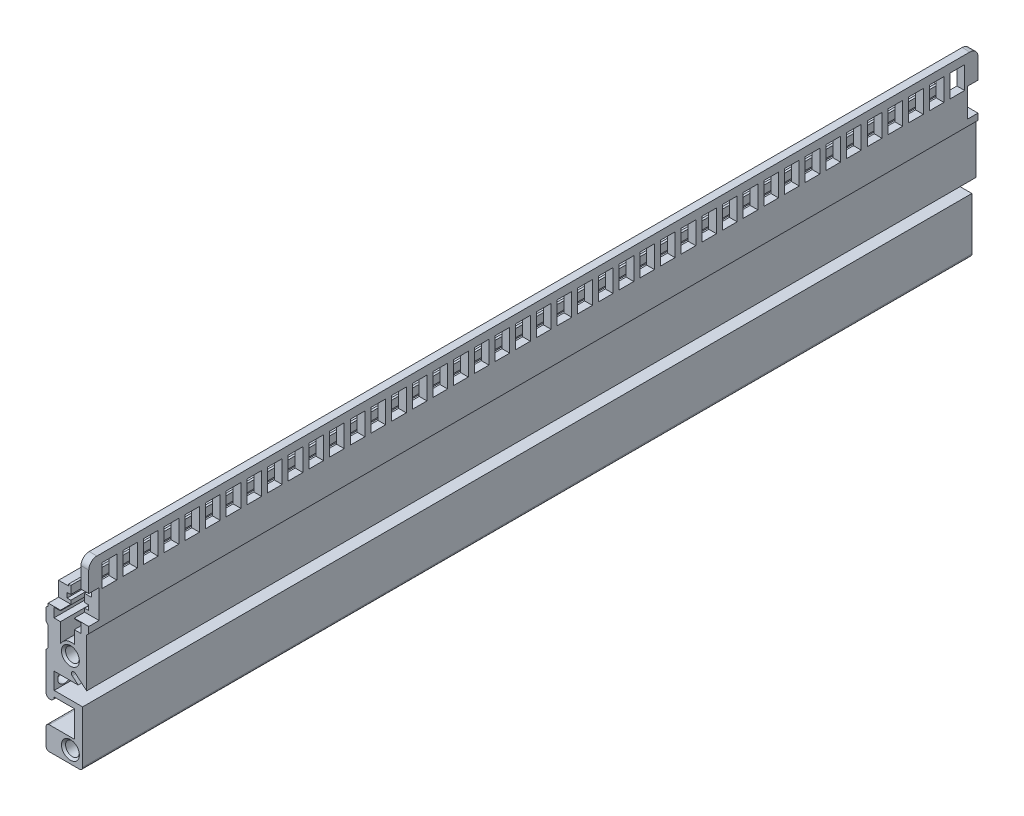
SolidWorks part; units mm, degrees
ref_plane "前视基准面" through (0, 0, 0) normal (0, 0, 1) x (1, 0, 0)
ref_plane "上视基准面" through (0, 0, 0) normal (0, 1, 0) x (1, 0, 0)
ref_plane "右视基准面" through (0, 0, 0) normal (1, 0, 0) x (0, 0, -1)
sketch "草图1" plane through (0, 0, 0) normal (0, 0, 1) x (1, 0, 0)
  line L0 (2.6, 12.5) -> (2.6, 22.5)
  line L1 (0.95, 12.5) -> (2.6, 12.5)
  line L2 (2.6, 22.5) -> (4.5, 22.5)
  line L3 (0.95, 10.55) -> (0.95, 12.5)
  line L4 (4.5, 22.5) -> (4.5, 6.95)
  line L5 (1.85, 10.55) -> (0.95, 10.55)
  line L6 (4, 6.45) -> (4.5, 6.95)
  line L7 (1.85, 9.35) -> (1.85, 10.55)
  line L8 (4, 6.45) -> (4, -5.4458)
  line L9 (0.95, 9.35) -> (1.85, 9.35)
  line L10 (1.2224, -3.1152) -> (4, -5.4458)
  line L11 (0.95, 8.35) -> (0.95, 9.35)
  line L12 (2.55, 8.35) -> (0.95, 8.35)
  line L13 (0.4511, -4.0344) -> (1.8998, -5.25)
  line L14 (2.55, 6.05) -> (2.55, 8.35)
  line L15 (-4, -5.25) -> (1.8998, -5.25)
  line L16 (0.95, 6.05) -> (2.55, 6.05)
  line L17 (-4, -9.35) -> (-4, -5.25)
  line L18 (0.95, 2.9172) -> (0.95, 6.05)
  line L19 (-4, -9.35) -> (3, -9.35)
  line L20 (3, -9.35) -> (3, -22.2)
  line L21 (-2.45, 6.05) -> (-2.45, 1.3077)
  line L22 (-4.05, 6.05) -> (-2.45, 6.05)
  line L23 (2.2, -23) -> (-5.2, -23)
  line L24 (-4.05, 8.35) -> (-4.05, 6.05)
  line L25 (-2.45, 8.35) -> (-4.05, 8.35)
  line L26 (-6, -22.2) -> (-6, -18.05)
  line L27 (-2.45, 9.35) -> (-2.45, 8.35)
  line L28 (-3.35, 9.35) -> (-2.45, 9.35)
  line L29 (-5.2, -17.25) -> (1, -17.25)
  line L30 (-3.35, 10.55) -> (-3.35, 9.35)
  line L31 (1, -10.75) -> (1, -17.25)
  line L32 (-2.45, 10.55) -> (-3.35, 10.55)
  line L33 (-4, -10.75) -> (1, -10.75)
  line L34 (-2.45, 12.5) -> (-2.45, 10.55)
  line L35 (-2.45, 12.5) -> (-3, 12.5)
  line L36 (-6, -10.75) -> (-6, -1.6)
  line L37 (-3, 12.5) -> (-3, 12.1)
  line L38 (-6, -1.6) -> (-5.5501, -1.1002)
  line L39 (-3, 12.1) -> (-5.45, 12.1)
  line L40 (-5.5499, 3.8998) -> (-5.5501, -1.1002)
  line L41 (-5.45, 12.1) -> (-5.45, 7.7)
  line L42 (-5.5499, 3.8998) -> (-6, 4.4)
  line L43 (-5.45, 7.7) -> (-5.7, 7.7)
  line L44 (-6, 4.4) -> (-6, 7.4)
  line L45 (-6, 7.4) -> (-5.7, 7.7)
  circle A0 centre (0, 0) radius 1.7
  circle A1 centre (0, -20) radius 1.7
  arc A2 (1.2224, -3.1152) -> (0.4511, -4.0344) centre (0.8368, -3.5748) ccw
  arc A3 (0.95, 2.9172) -> (-2.45, 1.3077) centre (0.25, 0) ccw
  arc A4 (2.2, -23) -> (3, -22.2) centre (2.2, -22.2) ccw
  arc A5 (-6, -22.2) -> (-5.2, -23) centre (-5.2, -22.2) ccw
  arc A6 (-5.2, -17.25) -> (-6, -18.05) centre (-5.2, -18.05) ccw
  arc A7 (-6, -10.75) -> (-4, -10.75) centre (-5, -10.75) ccw
extrude "凸台-拉伸1" add sketch "草图1" against normal blind 218.44
fillet "圆角1" radius 2 2 edges at (3.55, 22.5, -218.44) (3.55, 22.5, 0)
sketch "草图2" plane through (4.5, 0, 0) normal (1, 0, 0) x (0, 0, -1)
  line L0 (8.36, 20.45) -> (11.96, 20.45)
  line L1 (3.28, 20.45) -> (6.88, 20.45)
  line L2 (3.28, 20.45) -> (3.28, 14.95)
  line L3 (3.28, 14.95) -> (6.88, 14.95)
  line L4 (6.88, 20.45) -> (6.88, 14.95)
  line L5 (5.08, 20.45) -> (5.08, 14.95) construction
  line L6 (3.28, 17.7) -> (6.88, 17.7) construction
  line L7 (216.44, 22.5) -> (2, 22.5) construction
  line L8 (0, 20.5) -> (0, 12.5) construction
  line L9 (8.36, 20.45) -> (8.36, 14.95)
  line L10 (8.36, 14.95) -> (11.96, 14.95)
  line L11 (11.96, 20.45) -> (11.96, 14.95)
  line L12 (10.16, 20.45) -> (10.16, 14.95) construction
  line L13 (8.36, 17.7) -> (11.96, 17.7) construction
  line L14 (13.44, 20.45) -> (17.04, 20.45)
  line L15 (13.44, 20.45) -> (13.44, 14.95)
  line L16 (13.44, 14.95) -> (17.04, 14.95)
  line L17 (17.04, 20.45) -> (17.04, 14.95)
  line L18 (15.24, 20.45) -> (15.24, 14.95) construction
  line L19 (13.44, 17.7) -> (17.04, 17.7) construction
  line L20 (18.52, 20.45) -> (22.12, 20.45)
  line L21 (18.52, 20.45) -> (18.52, 14.95)
  line L22 (18.52, 14.95) -> (22.12, 14.95)
  line L23 (22.12, 20.45) -> (22.12, 14.95)
  line L24 (20.32, 20.45) -> (20.32, 14.95) construction
  line L25 (18.52, 17.7) -> (22.12, 17.7) construction
  line L26 (23.6, 20.45) -> (27.2, 20.45)
  line L27 (23.6, 20.45) -> (23.6, 14.95)
  line L28 (23.6, 14.95) -> (27.2, 14.95)
  line L29 (27.2, 20.45) -> (27.2, 14.95)
  line L30 (25.4, 20.45) -> (25.4, 14.95) construction
  line L31 (23.6, 17.7) -> (27.2, 17.7) construction
  line L32 (28.68, 20.45) -> (32.28, 20.45)
  line L33 (28.68, 20.45) -> (28.68, 14.95)
  line L34 (28.68, 14.95) -> (32.28, 14.95)
  line L35 (32.28, 20.45) -> (32.28, 14.95)
  line L36 (30.48, 20.45) -> (30.48, 14.95) construction
  line L37 (28.68, 17.7) -> (32.28, 17.7) construction
  line L38 (33.76, 20.45) -> (37.36, 20.45)
  line L39 (33.76, 20.45) -> (33.76, 14.95)
  line L40 (33.76, 14.95) -> (37.36, 14.95)
  line L41 (37.36, 20.45) -> (37.36, 14.95)
  line L42 (35.56, 20.45) -> (35.56, 14.95) construction
  line L43 (33.76, 17.7) -> (37.36, 17.7) construction
  line L44 (38.84, 20.45) -> (42.44, 20.45)
  line L45 (38.84, 20.45) -> (38.84, 14.95)
  line L46 (38.84, 14.95) -> (42.44, 14.95)
  line L47 (42.44, 20.45) -> (42.44, 14.95)
  line L48 (40.64, 20.45) -> (40.64, 14.95) construction
  line L49 (38.84, 17.7) -> (42.44, 17.7) construction
  line L50 (43.92, 20.45) -> (47.52, 20.45)
  line L51 (43.92, 20.45) -> (43.92, 14.95)
  line L52 (43.92, 14.95) -> (47.52, 14.95)
  line L53 (47.52, 20.45) -> (47.52, 14.95)
  line L54 (45.72, 20.45) -> (45.72, 14.95) construction
  line L55 (43.92, 17.7) -> (47.52, 17.7) construction
  line L56 (49, 20.45) -> (52.6, 20.45)
  line L57 (49, 20.45) -> (49, 14.95)
  line L58 (49, 14.95) -> (52.6, 14.95)
  line L59 (52.6, 20.45) -> (52.6, 14.95)
  line L60 (50.8, 20.45) -> (50.8, 14.95) construction
  line L61 (49, 17.7) -> (52.6, 17.7) construction
  line L62 (54.08, 20.45) -> (57.68, 20.45)
  line L63 (54.08, 20.45) -> (54.08, 14.95)
  line L64 (54.08, 14.95) -> (57.68, 14.95)
  line L65 (57.68, 20.45) -> (57.68, 14.95)
  line L66 (55.88, 20.45) -> (55.88, 14.95) construction
  line L67 (54.08, 17.7) -> (57.68, 17.7) construction
  line L68 (59.16, 20.45) -> (62.76, 20.45)
  line L69 (59.16, 20.45) -> (59.16, 14.95)
  line L70 (59.16, 14.95) -> (62.76, 14.95)
  line L71 (62.76, 20.45) -> (62.76, 14.95)
  line L72 (60.96, 20.45) -> (60.96, 14.95) construction
  line L73 (59.16, 17.7) -> (62.76, 17.7) construction
  line L74 (64.24, 20.45) -> (67.84, 20.45)
  line L75 (64.24, 20.45) -> (64.24, 14.95)
  line L76 (64.24, 14.95) -> (67.84, 14.95)
  line L77 (67.84, 20.45) -> (67.84, 14.95)
  line L78 (66.04, 20.45) -> (66.04, 14.95) construction
  line L79 (64.24, 17.7) -> (67.84, 17.7) construction
  line L80 (69.32, 20.45) -> (72.92, 20.45)
  line L81 (69.32, 20.45) -> (69.32, 14.95)
  line L82 (69.32, 14.95) -> (72.92, 14.95)
  line L83 (72.92, 20.45) -> (72.92, 14.95)
  line L84 (71.12, 20.45) -> (71.12, 14.95) construction
  line L85 (69.32, 17.7) -> (72.92, 17.7) construction
  line L86 (74.4, 20.45) -> (78, 20.45)
  line L87 (74.4, 20.45) -> (74.4, 14.95)
  line L88 (74.4, 14.95) -> (78, 14.95)
  line L89 (78, 20.45) -> (78, 14.95)
  line L90 (76.2, 20.45) -> (76.2, 14.95) construction
  line L91 (74.4, 17.7) -> (78, 17.7) construction
  line L92 (79.48, 20.45) -> (83.08, 20.45)
  line L93 (79.48, 20.45) -> (79.48, 14.95)
  line L94 (79.48, 14.95) -> (83.08, 14.95)
  line L95 (83.08, 20.45) -> (83.08, 14.95)
  line L96 (81.28, 20.45) -> (81.28, 14.95) construction
  line L97 (79.48, 17.7) -> (83.08, 17.7) construction
  line L98 (84.56, 20.45) -> (88.16, 20.45)
  line L99 (84.56, 20.45) -> (84.56, 14.95)
  line L100 (84.56, 14.95) -> (88.16, 14.95)
  line L101 (88.16, 20.45) -> (88.16, 14.95)
  line L102 (86.36, 20.45) -> (86.36, 14.95) construction
  line L103 (84.56, 17.7) -> (88.16, 17.7) construction
  line L104 (89.64, 20.45) -> (93.24, 20.45)
  line L105 (89.64, 20.45) -> (89.64, 14.95)
  line L106 (89.64, 14.95) -> (93.24, 14.95)
  line L107 (93.24, 20.45) -> (93.24, 14.95)
  line L108 (91.44, 20.45) -> (91.44, 14.95) construction
  line L109 (89.64, 17.7) -> (93.24, 17.7) construction
  line L110 (94.72, 20.45) -> (98.32, 20.45)
  line L111 (94.72, 20.45) -> (94.72, 14.95)
  line L112 (94.72, 14.95) -> (98.32, 14.95)
  line L113 (98.32, 20.45) -> (98.32, 14.95)
  line L114 (96.52, 20.45) -> (96.52, 14.95) construction
  line L115 (94.72, 17.7) -> (98.32, 17.7) construction
  line L116 (99.8, 20.45) -> (103.4, 20.45)
  line L117 (99.8, 20.45) -> (99.8, 14.95)
  line L118 (99.8, 14.95) -> (103.4, 14.95)
  line L119 (103.4, 20.45) -> (103.4, 14.95)
  line L120 (101.6, 20.45) -> (101.6, 14.95) construction
  line L121 (99.8, 17.7) -> (103.4, 17.7) construction
  line L122 (104.88, 20.45) -> (108.48, 20.45)
  line L123 (104.88, 20.45) -> (104.88, 14.95)
  line L124 (104.88, 14.95) -> (108.48, 14.95)
  line L125 (108.48, 20.45) -> (108.48, 14.95)
  line L126 (106.68, 20.45) -> (106.68, 14.95) construction
  line L127 (104.88, 17.7) -> (108.48, 17.7) construction
  line L128 (109.96, 20.45) -> (113.56, 20.45)
  line L129 (109.96, 20.45) -> (109.96, 14.95)
  line L130 (109.96, 14.95) -> (113.56, 14.95)
  line L131 (113.56, 20.45) -> (113.56, 14.95)
  line L132 (111.76, 20.45) -> (111.76, 14.95) construction
  line L133 (109.96, 17.7) -> (113.56, 17.7) construction
  line L134 (115.04, 20.45) -> (118.64, 20.45)
  line L135 (115.04, 20.45) -> (115.04, 14.95)
  line L136 (115.04, 14.95) -> (118.64, 14.95)
  line L137 (118.64, 20.45) -> (118.64, 14.95)
  line L138 (116.84, 20.45) -> (116.84, 14.95) construction
  line L139 (115.04, 17.7) -> (118.64, 17.7) construction
  line L140 (120.12, 20.45) -> (123.72, 20.45)
  line L141 (120.12, 20.45) -> (120.12, 14.95)
  line L142 (120.12, 14.95) -> (123.72, 14.95)
  line L143 (123.72, 20.45) -> (123.72, 14.95)
  line L144 (121.92, 20.45) -> (121.92, 14.95) construction
  line L145 (120.12, 17.7) -> (123.72, 17.7) construction
  line L146 (125.2, 20.45) -> (128.8, 20.45)
  line L147 (125.2, 20.45) -> (125.2, 14.95)
  line L148 (125.2, 14.95) -> (128.8, 14.95)
  line L149 (128.8, 20.45) -> (128.8, 14.95)
  line L150 (127, 20.45) -> (127, 14.95) construction
  line L151 (125.2, 17.7) -> (128.8, 17.7) construction
  line L152 (130.28, 20.45) -> (133.88, 20.45)
  line L153 (130.28, 20.45) -> (130.28, 14.95)
  line L154 (130.28, 14.95) -> (133.88, 14.95)
  line L155 (133.88, 20.45) -> (133.88, 14.95)
  line L156 (132.08, 20.45) -> (132.08, 14.95) construction
  line L157 (130.28, 17.7) -> (133.88, 17.7) construction
  line L158 (135.36, 20.45) -> (138.96, 20.45)
  line L159 (135.36, 20.45) -> (135.36, 14.95)
  line L160 (135.36, 14.95) -> (138.96, 14.95)
  line L161 (138.96, 20.45) -> (138.96, 14.95)
  line L162 (137.16, 20.45) -> (137.16, 14.95) construction
  line L163 (135.36, 17.7) -> (138.96, 17.7) construction
  line L164 (140.44, 20.45) -> (144.04, 20.45)
  line L165 (140.44, 20.45) -> (140.44, 14.95)
  line L166 (140.44, 14.95) -> (144.04, 14.95)
  line L167 (144.04, 20.45) -> (144.04, 14.95)
  line L168 (142.24, 20.45) -> (142.24, 14.95) construction
  line L169 (140.44, 17.7) -> (144.04, 17.7) construction
  line L170 (145.52, 20.45) -> (149.12, 20.45)
  line L171 (145.52, 20.45) -> (145.52, 14.95)
  line L172 (145.52, 14.95) -> (149.12, 14.95)
  line L173 (149.12, 20.45) -> (149.12, 14.95)
  line L174 (147.32, 20.45) -> (147.32, 14.95) construction
  line L175 (145.52, 17.7) -> (149.12, 17.7) construction
  line L176 (150.6, 20.45) -> (154.2, 20.45)
  line L177 (150.6, 20.45) -> (150.6, 14.95)
  line L178 (150.6, 14.95) -> (154.2, 14.95)
  line L179 (154.2, 20.45) -> (154.2, 14.95)
  line L180 (152.4, 20.45) -> (152.4, 14.95) construction
  line L181 (150.6, 17.7) -> (154.2, 17.7) construction
  line L182 (155.68, 20.45) -> (159.28, 20.45)
  line L183 (155.68, 20.45) -> (155.68, 14.95)
  line L184 (155.68, 14.95) -> (159.28, 14.95)
  line L185 (159.28, 20.45) -> (159.28, 14.95)
  line L186 (157.48, 20.45) -> (157.48, 14.95) construction
  line L187 (155.68, 17.7) -> (159.28, 17.7) construction
  line L188 (160.76, 20.45) -> (164.36, 20.45)
  line L189 (160.76, 20.45) -> (160.76, 14.95)
  line L190 (160.76, 14.95) -> (164.36, 14.95)
  line L191 (164.36, 20.45) -> (164.36, 14.95)
  line L192 (162.56, 20.45) -> (162.56, 14.95) construction
  line L193 (160.76, 17.7) -> (164.36, 17.7) construction
  line L194 (165.84, 20.45) -> (169.44, 20.45)
  line L195 (165.84, 20.45) -> (165.84, 14.95)
  line L196 (165.84, 14.95) -> (169.44, 14.95)
  line L197 (169.44, 20.45) -> (169.44, 14.95)
  line L198 (167.64, 20.45) -> (167.64, 14.95) construction
  line L199 (165.84, 17.7) -> (169.44, 17.7) construction
  line L200 (170.92, 20.45) -> (174.52, 20.45)
  line L201 (170.92, 20.45) -> (170.92, 14.95)
  line L202 (170.92, 14.95) -> (174.52, 14.95)
  line L203 (174.52, 20.45) -> (174.52, 14.95)
  line L204 (172.72, 20.45) -> (172.72, 14.95) construction
  line L205 (170.92, 17.7) -> (174.52, 17.7) construction
  line L206 (176, 20.45) -> (179.6, 20.45)
  line L207 (176, 20.45) -> (176, 14.95)
  line L208 (176, 14.95) -> (179.6, 14.95)
  line L209 (179.6, 20.45) -> (179.6, 14.95)
  line L210 (177.8, 20.45) -> (177.8, 14.95) construction
  line L211 (176, 17.7) -> (179.6, 17.7) construction
  line L212 (181.08, 20.45) -> (184.68, 20.45)
  line L213 (181.08, 20.45) -> (181.08, 14.95)
  line L214 (181.08, 14.95) -> (184.68, 14.95)
  line L215 (184.68, 20.45) -> (184.68, 14.95)
  line L216 (182.88, 20.45) -> (182.88, 14.95) construction
  line L217 (181.08, 17.7) -> (184.68, 17.7) construction
  line L218 (186.16, 20.45) -> (189.76, 20.45)
  line L219 (186.16, 20.45) -> (186.16, 14.95)
  line L220 (186.16, 14.95) -> (189.76, 14.95)
  line L221 (189.76, 20.45) -> (189.76, 14.95)
  line L222 (187.96, 20.45) -> (187.96, 14.95) construction
  line L223 (186.16, 17.7) -> (189.76, 17.7) construction
  line L224 (191.24, 20.45) -> (194.84, 20.45)
  line L225 (191.24, 20.45) -> (191.24, 14.95)
  line L226 (191.24, 14.95) -> (194.84, 14.95)
  line L227 (194.84, 20.45) -> (194.84, 14.95)
  line L228 (193.04, 20.45) -> (193.04, 14.95) construction
  line L229 (191.24, 17.7) -> (194.84, 17.7) construction
  line L230 (196.32, 20.45) -> (199.92, 20.45)
  line L231 (196.32, 20.45) -> (196.32, 14.95)
  line L232 (196.32, 14.95) -> (199.92, 14.95)
  line L233 (199.92, 20.45) -> (199.92, 14.95)
  line L234 (198.12, 20.45) -> (198.12, 14.95) construction
  line L235 (196.32, 17.7) -> (199.92, 17.7) construction
  line L236 (201.4, 20.45) -> (205, 20.45)
  line L237 (201.4, 20.45) -> (201.4, 14.95)
  line L238 (201.4, 14.95) -> (205, 14.95)
  line L239 (205, 20.45) -> (205, 14.95)
  line L240 (203.2, 20.45) -> (203.2, 14.95) construction
  line L241 (201.4, 17.7) -> (205, 17.7) construction
  line L242 (206.48, 20.45) -> (210.08, 20.45)
  line L243 (206.48, 20.45) -> (206.48, 14.95)
  line L244 (206.48, 14.95) -> (210.08, 14.95)
  line L245 (210.08, 20.45) -> (210.08, 14.95)
  line L246 (208.28, 20.45) -> (208.28, 14.95) construction
  line L247 (206.48, 17.7) -> (210.08, 17.7) construction
  line L248 (211.56, 20.45) -> (215.16, 20.45)
  line L249 (211.56, 20.45) -> (211.56, 14.95)
  line L250 (211.56, 14.95) -> (215.16, 14.95)
  line L251 (215.16, 20.45) -> (215.16, 14.95)
  line L252 (213.36, 20.45) -> (213.36, 14.95) construction
  line L253 (211.56, 17.7) -> (215.16, 17.7) construction
extrude "切除-拉伸1" cut sketch "草图2" against normal up to next (1.9 mm away)
sketch "草图3" plane through (4.5, 0, 0) normal (1, 0, 0) x (0, 0, -1)
  line L0 (216.44, 22.5) -> (2, 22.5) construction
  line L1 (0, 15.5) -> (2.54, 15.5)
  line L2 (0, 15.5) -> (0, 8.5)
  line L3 (0, 8.5) -> (2.54, 8.5)
  line L4 (2.54, 15.5) -> (2.54, 8.5)
  line L6 (0, 6.95) -> (0, 20.5) construction
  dimension "D1" = 7
  dimension "D2" = 2.54
  dimension "D3" = 7
  dimension "D4" = 0
extrude "切除-拉伸2" cut sketch "草图3" against normal through all
ref_plane "基准面2" through (0, 0, -109.22) normal (0, 0, 1) x (1, 0, 0)
mirror "镜向1" about plane through (0, 0, -109.22) normal (0, 0, 1) of "切除-拉伸2"
sketch "草图4" plane through (-6, 0, 0) normal (-1, 0, 0) x (0, 0, 1)
  line L0 (-218.44, -1.6) -> (-218.44, -10.75) construction
  line L1 (-218.44, -9.35) -> (0, -9.35) construction
  circle A0 centre (-215.9, -7.45) radius 1.65
  circle A1 centre (-210.82, -7.45) radius 1.65
  circle A2 centre (-205.74, -7.45) radius 1.65
  circle A3 centre (-200.66, -7.45) radius 1.65
  circle A4 centre (-195.58, -7.45) radius 1.65
  circle A5 centre (-190.5, -7.45) radius 1.65
  circle A6 centre (-185.42, -7.45) radius 1.65
  circle A7 centre (-180.34, -7.45) radius 1.65
  circle A8 centre (-175.26, -7.45) radius 1.65
  circle A9 centre (-170.18, -7.45) radius 1.65
  circle A10 centre (-165.1, -7.45) radius 1.65
  circle A11 centre (-160.02, -7.45) radius 1.65
  circle A12 centre (-154.94, -7.45) radius 1.65
  circle A13 centre (-149.86, -7.45) radius 1.65
  circle A14 centre (-144.78, -7.45) radius 1.65
  circle A15 centre (-139.7, -7.45) radius 1.65
  circle A16 centre (-134.62, -7.45) radius 1.65
  circle A17 centre (-129.54, -7.45) radius 1.65
  circle A18 centre (-124.46, -7.45) radius 1.65
  circle A19 centre (-119.38, -7.45) radius 1.65
  circle A20 centre (-114.3, -7.45) radius 1.65
  circle A21 centre (-109.22, -7.45) radius 1.65
  circle A22 centre (-104.14, -7.45) radius 1.65
  circle A23 centre (-99.06, -7.45) radius 1.65
  circle A24 centre (-93.98, -7.45) radius 1.65
  circle A25 centre (-88.9, -7.45) radius 1.65
  circle A26 centre (-83.82, -7.45) radius 1.65
  circle A27 centre (-78.74, -7.45) radius 1.65
  circle A28 centre (-73.66, -7.45) radius 1.65
  circle A29 centre (-68.58, -7.45) radius 1.65
  circle A30 centre (-63.5, -7.45) radius 1.65
  circle A31 centre (-58.42, -7.45) radius 1.65
  circle A32 centre (-53.34, -7.45) radius 1.65
  circle A33 centre (-48.26, -7.45) radius 1.65
  circle A34 centre (-43.18, -7.45) radius 1.65
  circle A35 centre (-38.1, -7.45) radius 1.65
  circle A36 centre (-33.02, -7.45) radius 1.65
  circle A37 centre (-27.94, -7.45) radius 1.65
  circle A38 centre (-22.86, -7.45) radius 1.65
  circle A39 centre (-17.78, -7.45) radius 1.65
  circle A40 centre (-12.7, -7.45) radius 1.65
  circle A41 centre (-7.62, -7.45) radius 1.65
  circle A42 centre (-2.54, -7.45) radius 1.65
extrude "切除-拉伸3" cut sketch "草图4" against normal up to next (2 mm away)
chamfer "倒角1" distance 0.5 angle 45 3 edges at (1.7, -20, 0) (1.7, 0, 0) (1.7, 0, -218.44)
chamfer "倒角2" distance 0.5 angle 45 1 edges at (1.7, -20, -218.44)
equation "\"D4@草图4\"=\"D1@凸台-拉伸1\"/5.08"
equation "\"D5@草图2\"=\"D1@凸台-拉伸1\"/5.08-1"
